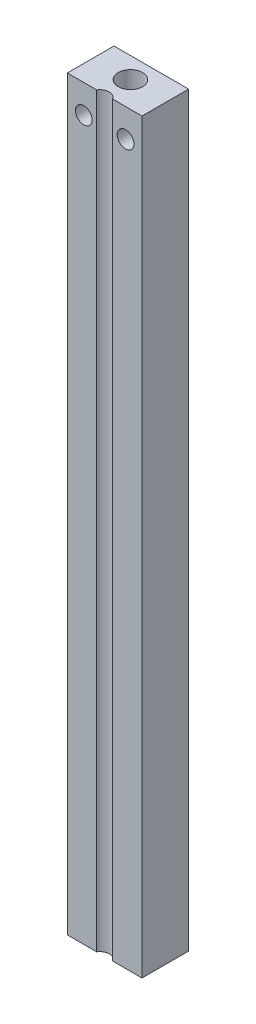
SolidWorks part; units mm, degrees
ref_plane "Front Plane" through (0, 0, 0) normal (0, 0, 1) x (1, 0, 0)
ref_plane "Top Plane" through (0, 0, 0) normal (0, 1, 0) x (1, 0, 0)
ref_plane "Right Plane" through (0, 0, 0) normal (1, 0, 0) x (0, 0, -1)
sketch "Sketch1" plane through (0, 0, 0) normal (0, 1, 0) x (1, 0, 0)
  line L0 (7.706, 0) -> (12.7, 0)
  line L1 (0, 0) -> (4.994, 0)
  line L2 (0, 0) -> (0, 7.9375)
  line L3 (0, 7.9375) -> (12.7, 7.9375)
  line L4 (12.7, 0) -> (12.7, 7.9375)
  arc A0 (7.706, 0) -> (4.994, 0) centre (6.35, -0.8255) ccw
extrude "Extrude1" add sketch "Sketch1" along normal blind 127
sketch "Sketch2" plane through (0, 127, 0) normal (0, 1, 0) x (-1, 0, 0)
  circle A0 centre (-6.35, -4.3815) radius 2.0828
extrude "Cut-Extrude1" cut sketch "Sketch2" against normal blind 12.7
sketch "Sketch3" plane through (0, 0, 0) normal (0, 0, 1) x (1, 0, 0)
  circle A0 centre (9.906, 122.174) radius 1.4224
  circle A1 centre (2.794, 122.174) radius 1.4224
extrude "Cut-Extrude2" cut sketch "Sketch3" against normal through all
sketch "Sketch4" plane through (0, 0, 0) normal (0, -1, 0) x (1, 0, 0)
  circle A0 centre (6.35, -2.794) radius 1.6256
extrude "Cut-Extrude3" cut sketch "Sketch4" against normal blind 12.7
